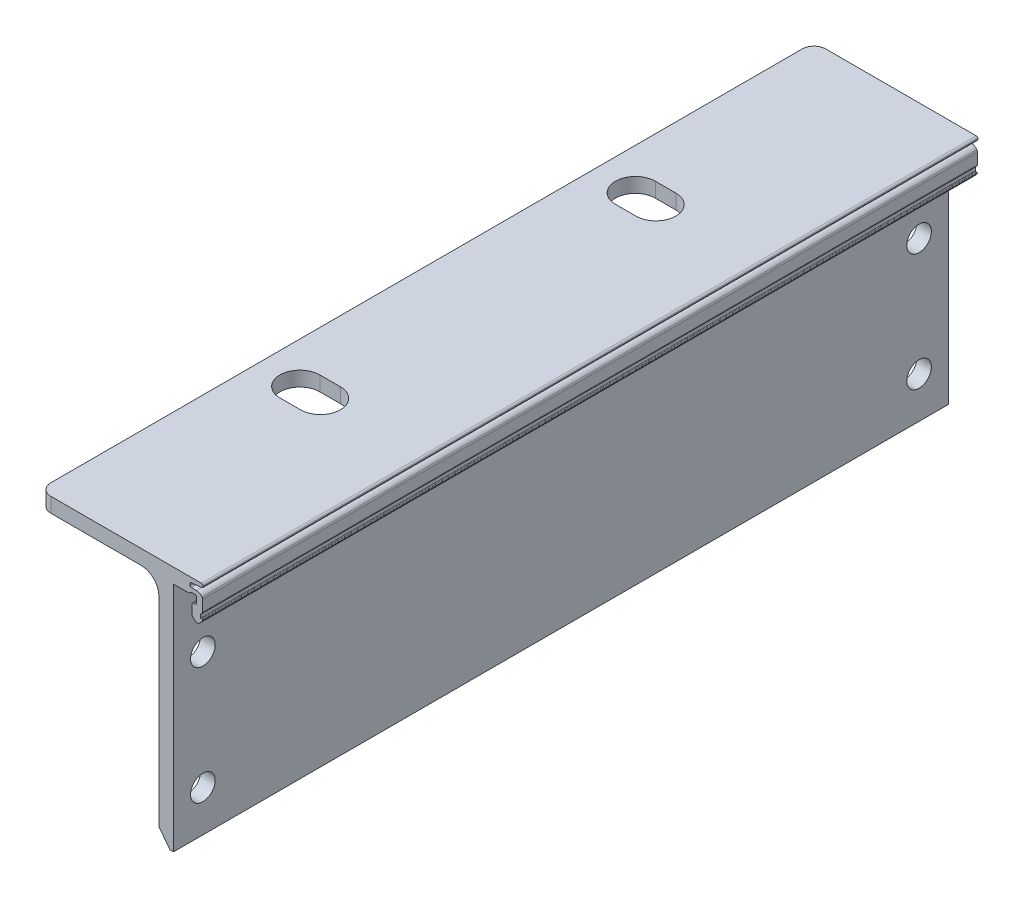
SolidWorks part; units mm, degrees
ref_plane "前视基准面" through (0, 0, 0) normal (0, 0, 1) x (1, 0, 0)
ref_plane "上视基准面" through (0, 0, 0) normal (0, 1, 0) x (1, 0, 0)
ref_plane "右视基准面" through (0, 0, 0) normal (1, 0, 0) x (0, 0, -1)
sketch "草图1" plane through (0, 0, 0) normal (0, 0, 1) x (1, 0, 0)
  line L0 (2329.984, -3290.1038) -> (2355.384, -3290.1038)
  line L1 (2329.984, -3292.6038) -> (2350.384, -3292.6038)
  line L2 (2352.884, -3292.6038) -> (2355.384, -3292.6038)
  line L3 (2350.384, -3292.6038) -> (2350.384, -3329.6038)
  line L4 (2352.884, -3292.6038) -> (2352.884, -3332.1038)
  line L5 (2355.384, -3292.6038) -> (2355.384, -3290.1038) construction
  line L6 (2355.384, -3290.1038) -> (2357.924, -3290.1038) construction
  line L8 (2329.984, -3290.1038) -> (2329.984, -3292.6038)
  line L10 (2352.884, -3332.1038) -> (2352.284, -3332.1038)
  line L11 (2350.384, -3329.6038) -> (2352.284, -3332.1038)
  line L12 (2356.524, -3292.3038) -> (2355.988, -3292.3038)
  line L13 (2357.5972, -3295.408) -> (2357.724, -3295.408)
  line L14 (2357.624, -3290.1038) -> (2357.924, -3290.1038) construction
  line L15 (2357.8006, -3295.5917) -> (2357.3831, -3296.0891)
  line L16 (2357.4972, -3294.808) -> (2357.4972, -3295.308)
  line L17 (2357.824, -3295.508) -> (2357.824, -3295.5274)
  line L18 (2357.824, -3292.376) -> (2357.824, -3294.2738)
  line L19 (2356.324, -3293.7038) -> (2356.524, -3293.7038)
  line L20 (2356.024, -3295.4545) -> (2356.024, -3294.0038)
  line L21 (2357.7449, -3290.6914) -> (2355.9031, -3290.8849)
  line L22 (2355.724, -3291.0839) -> (2355.724, -3291.4038)
  line L23 (2355.924, -3291.6038) -> (2356.77, -3291.6038)
  line L24 (2357.924, -3290.4038) -> (2357.924, -3290.4925)
  line L25 (2356.465, -3296.0891) -> (2356.0943, -3295.6474)
  line L26 (2356.824, -3293.4038) -> (2356.824, -3292.6038)
  line L27 (2357.924, -3290.4038) -> (2357.924, -3290.1038) construction
  line L28 (2355.384, -3292.6038) -> (2355.4683, -3292.6038)
  line L29 (2355.384, -3290.1038) -> (2357.624, -3290.1038)
  arc A0 (2357.4972, -3294.808) -> (2357.6606, -3294.5409) centre (2357.7972, -3294.808) cw
  arc A1 (2356.77, -3291.6038) -> (2357.7198, -3292.0704) centre (2356.77, -3292.8038) cw
  arc A2 (2357.824, -3295.5274) -> (2357.8006, -3295.5917) centre (2357.724, -3295.5274) cw
  arc A3 (2355.724, -3291.0839) -> (2355.9031, -3290.8849) centre (2355.924, -3291.0839) cw
  arc A4 (2357.924, -3290.4925) -> (2357.7449, -3290.6914) centre (2357.724, -3290.4925) cw
  arc A5 (2355.7282, -3292.4538) -> (2355.4683, -3292.6038) centre (2355.4683, -3292.3038) cw
  arc A6 (2357.624, -3290.1038) -> (2357.924, -3290.4038) centre (2357.624, -3290.4038) cw
  arc A7 (2357.5972, -3295.408) -> (2357.4972, -3295.308) centre (2357.5972, -3295.308) cw
  arc A8 (2357.824, -3294.2738) -> (2357.6606, -3294.5409) centre (2357.524, -3294.2738) cw
  arc A9 (2355.924, -3291.6038) -> (2355.724, -3291.4038) centre (2355.924, -3291.4038) cw
  arc A10 (2356.524, -3292.3038) -> (2356.824, -3292.6038) centre (2356.524, -3292.6038) cw
  arc A11 (2356.0943, -3295.6474) -> (2356.024, -3295.4545) centre (2356.324, -3295.4545) cw
  arc A12 (2355.7282, -3292.4538) -> (2355.988, -3292.3038) centre (2355.988, -3292.6038) cw
  arc A13 (2357.7198, -3292.0704) -> (2357.824, -3292.376) centre (2357.324, -3292.376) cw
  arc A14 (2356.024, -3294.0038) -> (2356.324, -3293.7038) centre (2356.324, -3294.0038) cw
  arc A15 (2356.824, -3293.4038) -> (2356.524, -3293.7038) centre (2356.524, -3293.4038) cw
  arc A16 (2357.3831, -3296.0891) -> (2356.465, -3296.0891) centre (2356.924, -3295.7038) cw
  arc A17 (2357.724, -3295.408) -> (2357.824, -3295.508) centre (2357.724, -3295.508) cw
  dimension "D1" = 39.5
  dimension "D2" = 0.6
  dimension "D3" = 2.5
  dimension "D4" = 20.4
  dimension "D5" = 127.235
extrude "凸台-拉伸1" add sketch "草图1" along normal mid plane 132
fillet "圆角2" radius 3 1 edges at (2350.384, -3292.6038, 0)
sketch "草图2" plane through (0, -3290.1038, 0) normal (0, 1, 0) x (1, 0, 0)
  line L0 (2338.734, 31.975) -> (2338.734, 25.175) construction
  line L3 (2370.3278, 0) -> (2329.984, 0) construction
  line L5 (2329.984, -66) -> (2329.984, 66) construction
  line L6 (2340.484, -25.175) -> (2336.984, -25.175)
  line L7 (2340.484, -31.975) -> (2336.984, -31.975)
  line L9 (2340.484, 31.975) -> (2336.984, 31.975)
  line L10 (2340.484, 25.175) -> (2336.984, 25.175)
  arc A0 (2336.984, -31.975) -> (2336.984, -25.175) centre (2336.984, -28.575) cw
  arc A1 (2336.984, 31.975) -> (2336.984, 25.175) centre (2336.984, 28.575) ccw
  arc A2 (2340.484, -25.175) -> (2340.484, -31.975) centre (2340.484, -28.575) cw
  arc A4 (2340.484, 25.175) -> (2340.484, 31.975) centre (2340.484, 28.575) ccw
  dimension "D4" = 8.75
  dimension "D1" = 57.15
  dimension "D5" = 3.5
  dimension "D6" = 3.4
extrude "切除-拉伸1" cut sketch "草图2" against normal through all
sketch "草图3" plane through (2350.384, 0, 0) normal (-1, 0, 0) x (0, 0, 1)
  line L0 (-66, -3295.6038) -> (-66, -3329.6038) construction
  line L1 (66, -3290.1038) -> (-66, -3290.1038) construction
  line L2 (0, -3290.1038) -> (0, -3332.1038) construction
  line L3 (66, -3332.1038) -> (-66, -3332.1038) construction
  circle A0 centre (-61, -3305.1038) radius 2.1
  circle A2 centre (-61, -3325.1038) radius 2.1
  circle A5 centre (61, -3305.1038) radius 2.1
  circle A7 centre (61, -3325.1038) radius 2.1
  dimension "D1" = 4.2
  dimension "D2" = 5
  dimension "D3" = 15
  dimension "D4" = 20
  dimension "D10" = 20
  dimension "D11" = 4.2
  dimension "D12" = 4.2
extrude "切除-拉伸2" cut sketch "草图3" against normal through all
fillet "圆角1" radius 2 2 edges at (2329.984, -3291.3538, -66) (2329.984, -3291.3538, 66)
